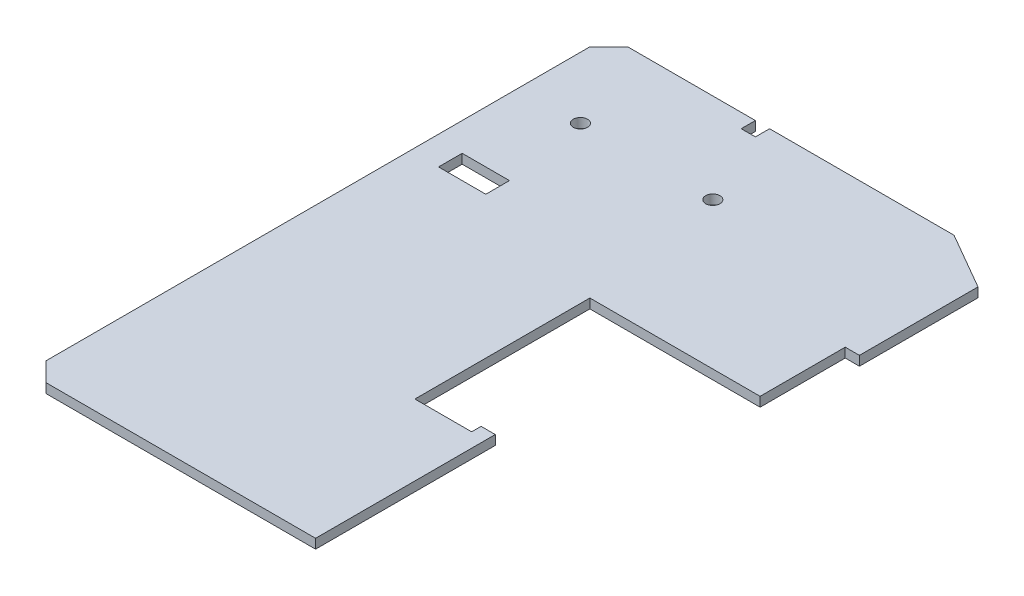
SolidWorks part; units mm, degrees
ref_plane "Face" through (0, 0, 0) normal (0, 0, 1) x (1, 0, 0)
ref_plane "Dessus" through (0, 0, 0) normal (0, 1, 0) x (1, 0, 0)
ref_plane "Droite" through (0, 0, 0) normal (1, 0, 0) x (0, 0, -1)
sketch "Esquisse1" plane through (0, 0, 0) normal (0, 1, 0) x (1, 0, 0)
  line L0 (-23, -16) -> (-23, 41.5)
  line L1 (-23, 41.5) -> (-21, 43.5)
  line L2 (-21, 43.5) -> (-7.5, 43.5)
  line L3 (-7.5, 43.5) -> (-7.5, 42)
  line L4 (-7.5, 42) -> (-6, 42)
  line L5 (-6, 42) -> (-6, 43.5)
  line L6 (-6, 43.5) -> (13.5, 43.5)
  line L7 (13.5, 43.5) -> (19.5, 40.0359)
  line L8 (19.5, 40.0359) -> (19.5, 27.5)
  line L9 (19.5, 27.5) -> (18, 27.5)
  line L10 (18, 27.5) -> (18, 18.5)
  line L11 (18, 18.5) -> (0, 18.5)
  line L12 (0, 18.5) -> (0, 0)
  line L13 (0, 0) -> (6, 0)
  line L14 (7.5, 1) -> (7.5, -18)
  line L15 (7.5, -18) -> (-21, -18)
  line L16 (-21, -18) -> (-23, -16)
  line L17 (6, 0) -> (6, 1)
  line L18 (-20, 25) -> (-15, 25)
  line L19 (-20, 25) -> (-20, 22.5)
  line L20 (-20, 22.5) -> (-15, 22.5)
  line L21 (-15, 25) -> (-15, 22.5)
  line L22 (6, 1) -> (7.5, 1)
  circle A0 centre (-16.5, 34) radius 0.75
  circle A1 centre (-2.5, 34) radius 0.75
  dimension "D23" = 1.5
  dimension "D24" = 1.5
  dimension "D1" = 42.5
  dimension "D2" = 7.5
  dimension "D3" = 30.5
  dimension "D4" = 25
  dimension "D5" = 9
  dimension "D6" = 1.5
  dimension "D7" = 1.5
  dimension "D8" = 1.5
  dimension "D9" = 2
  dimension "D10" = 45
  dimension "D11" = 6
  dimension "D12" = 30
  dimension "D13" = 18.5
  dimension "D14" = 15.5
  dimension "D15" = 61.5
  dimension "D16" = 2
  dimension "D17" = 45
  dimension "D18" = 18.5
  dimension "D19" = 3
  dimension "D20" = 5
  dimension "D21" = 2.5
  dimension "D22" = 14
  dimension "D25" = 6.5
  dimension "D26" = 9.5
  dimension "D27" = 1.5
  dimension "D28" = 1
extrude "Extrusion1" add sketch "Esquisse1" along normal blind 1
